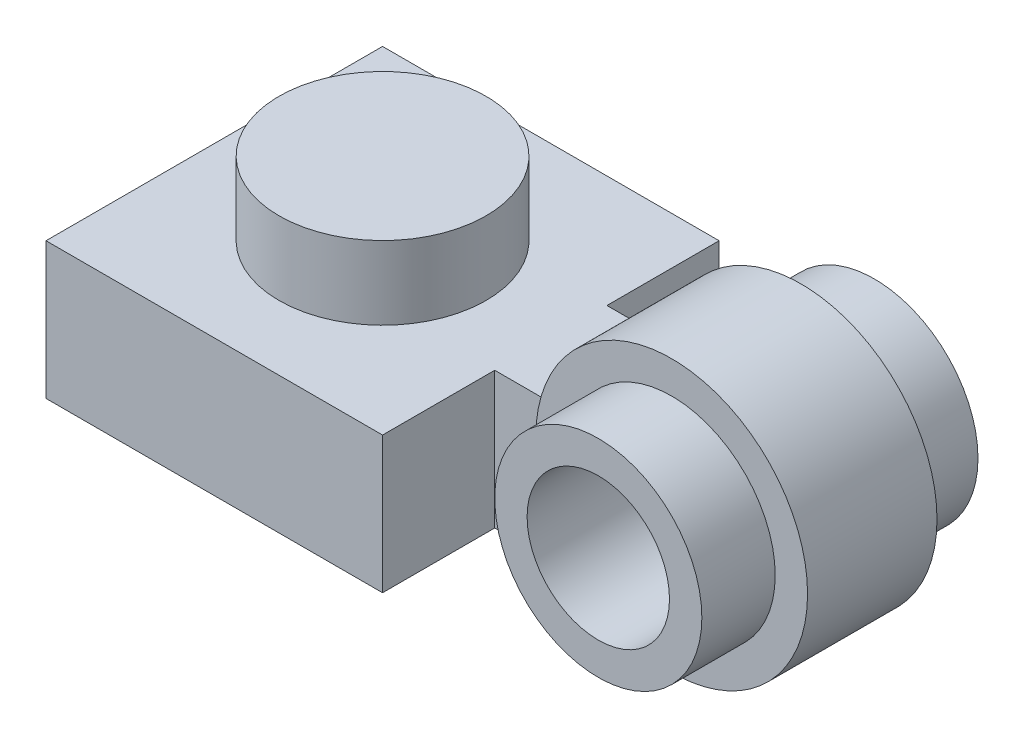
SolidWorks part; units mm, degrees
ref_plane "Front Plane" through (0, 0, 0) normal (0, 0, 1) x (1, 0, 0)
ref_plane "Top Plane" through (0, 0, 0) normal (0, 1, 0) x (1, 0, 0)
ref_plane "Right Plane" through (0, 0, 0) normal (1, 0, 0) x (0, 0, -1)
sketch "Sketch1" plane through (0, 0, 0) normal (0, 1, 0) x (1, 0, 0)
  line L1 (3.9, -3.9) -> (-3.9, -3.9)
  line L2 (3.9, -3.9) -> (3.9, 3.9)
  line L3 (3.9, 3.9) -> (-3.9, 3.9)
  line L4 (-3.9, -3.9) -> (-3.9, 3.9)
  line L5 (3.9, -3.9) -> (-3.9, 3.9) construction
  line L6 (3.9, 3.9) -> (-3.9, -3.9) construction
  point P0 (0, 0)
  dimension "D1" = 7.8
  dimension "D2" = 7.8
extrude "Extrude1" add sketch "Sketch1" along normal blind 3.166
sketch "Sketch2" plane through (0, 3.166, 0) normal (0, 1, 0) x (1, 0, 0)
  circle A0 centre (0, 0) radius 2.4
  dimension "D1" = 4.8
extrude "Extrude2" add sketch "Sketch2" along normal blind 1.7
sketch "Sketch3" plane through (0, 0, 0) normal (0, -1, 0) x (1, 0, 0)
  line L0 (-3.9, 3.9) -> (3.9, 3.9) construction
  line L1 (2.45, -2.45) -> (-2.45, -2.45)
  line L2 (2.45, -2.45) -> (2.45, 2.45)
  line L3 (2.45, 2.45) -> (-2.45, 2.45)
  line L4 (-2.45, -2.45) -> (-2.45, 2.45)
  line L5 (2.45, -2.45) -> (-2.45, 2.45) construction
  line L6 (2.45, 2.45) -> (-2.45, -2.45) construction
  line L7 (3.9, 3.9) -> (3.9, -3.9) construction
  point P0 (0, 0)
  dimension "D1" = 1.45
  dimension "D2" = 1.45
extrude "Extrude3" cut sketch "Sketch3" against normal blind 2.5
ref_plane " " through (3.9, 0, 0) normal (1, 0, 0) x (0, 0, -1)
sketch "Sketch5" plane through (3.9, 0, 0) normal (1, 0, 0) x (0, 0, -1)
  line L0 (-1.3, 3.166) -> (1.3, 3.166)
  line L1 (-3.9, 3.166) -> (3.9, 3.166) construction
  line L2 (1.3, 3.166) -> (1.3, 0)
  line L3 (-3.9, 0) -> (3.9, 0) construction
  line L4 (1.3, 0) -> (-1.3, 0)
  line L5 (-1.3, 0) -> (-1.3, 3.166)
  line L6 (0, 4.866) -> (0, 3.166) construction
  dimension "D1" = 2.6
  dimension "D2" = 1.3
extrude "Boss-Extrude2" add sketch "Sketch5" along normal blind 6.8
fillet "Fillet2" radius 1 2 edges at (10.7, 3.166, 0) (10.7, 0, 0)
sketch "Sketch7" plane through (0, 0, 0) normal (0, 0, 1) x (1, 0, 0)
  line L0 (3.9, -3.465) -> (3.9, 3.465) construction
  line L1 (-3.9, 0) -> (3.9, 0) construction
  circle A0 centre (8.2, 2.5) radius 3.15
  dimension "D1" = 6.3
  dimension "D2" = 4.3
  dimension "D3" = 2.5
extrude "Boss-Extrude5" add sketch "Sketch7" along normal mid plane 3
sketch "Sketch10" plane through (0, 0, 1.5) normal (0, 0, 1) x (1, 0, 0)
  circle A0 centre (8.2, 2.5) radius 2.4
  dimension "D1" = 4.8
extrude "Boss-Extrude6" add sketch "Sketch10" along normal blind 1.7
sketch "Sketch11" plane through (0, 0, -1.5) normal (0, 0, -1) x (-1, 0, 0)
  circle A0 centre (-8.2, 2.5) radius 2.4
  dimension "D1" = 4.8
extrude "Boss-Extrude7" add sketch "Sketch11" along normal blind 1.7
sketch "Sketch12" plane through (0, 0, -3.2) normal (0, 0, -1) x (-1, 0, 0)
  circle A0 centre (-8.2, 2.5) radius 1.65
  dimension "D1" = 3.3
extrude "Cut-Extrude2" cut sketch "Sketch12" against normal through all
